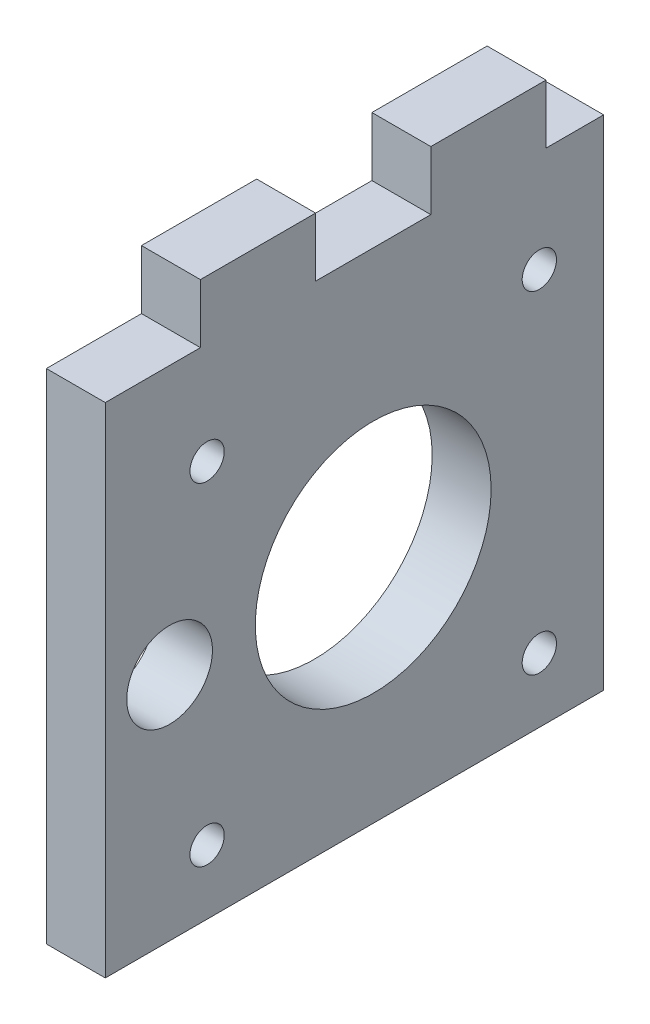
SolidWorks part; units mm, degrees
ref_plane "Front Plane" through (0, 0, 0) normal (0, 0, 1) x (1, 0, 0)
ref_plane "Top Plane" through (0, 0, 0) normal (0, 1, 0) x (1, 0, 0)
ref_plane "Right Plane" through (0, 0, 0) normal (1, 0, 0) x (0, 0, -1)
sketch "Sketch2" plane through (0, 0, 0) normal (1, 0, 0) x (0, 0, -1)
  line L4 (-46.5, 0) -> (-46.5, 46.5) construction
  line L13 (-43, 0) -> (0, 0)
  line L22 (0, 46.5) -> (0, 0) construction
  line L23 (-16.125, 46.5) -> (-26.875, 46.5)
  line L24 (-26.875, 46.5) -> (-26.875, 52)
  line L28 (-46.5, 0) -> (-43, 0)
  line L29 (-26.875, 52) -> (-37.625, 52)
  line L30 (-37.625, 52) -> (-37.625, 46.5)
  line L31 (-37.625, 46.5) -> (-46.5, 46.5)
  line L32 (-46.5, 46.5) -> (-46.5, 0)
  line L33 (-16.125, 46.5) -> (-16.125, 52)
  line L34 (-16.125, 52) -> (-5.375, 52)
  line L35 (-5.375, 52) -> (-5.375, 46.5)
  line L36 (-5.375, 46.5) -> (0, 46.5)
  line L37 (0, 46.5) -> (0, 0)
  circle A0 centre (-21.5, 21.5) radius 11
  circle A1 centre (-6, 37) radius 1.6
  circle A2 centre (-6, 6) radius 1.6
  circle A3 centre (-37, 6) radius 1.6
  circle A4 centre (-37, 37) radius 1.6
  circle A5 centre (-40.5, 21.5) radius 4
  point P10 (-21.5, 46.5)
  dimension "D3" = 22
  dimension "D4" = 3.2
  dimension "D5" = 3.2
  dimension "D6" = 3.2
  dimension "D7" = 3.2
  dimension "D11" = 8
  dimension "D13" = 10.75
  dimension "D2" = 10.75
  dimension "D8" = 3.5
  dimension "D9" = 19
  dimension "D10" = 43
  dimension "D12" = 10.75
  dimension "D14" = 46.5
  dimension "D15" = 5.375
  dimension "D16" = 8.875
  dimension "D17" = 5.5
  dimension "D18" = 21.9203
  dimension "D19" = 43.8406
extrude "Boss-Extrude2" add sketch "Sketch2" along normal blind 5.5
